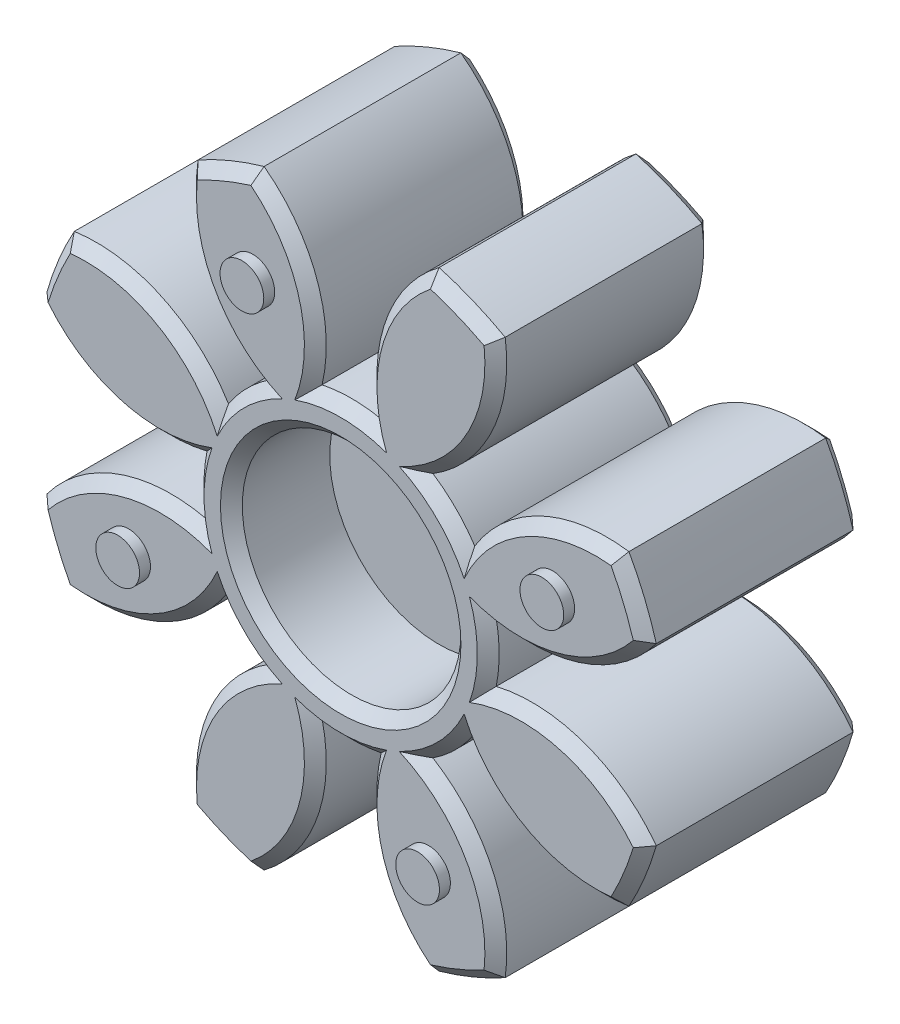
SolidWorks part; units mm, degrees
ref_plane "Front Plane" through (0, 0, 0) normal (0, 0, 1) x (1, 0, 0)
ref_plane "Top Plane" through (0, 0, 0) normal (0, 1, 0) x (1, 0, 0)
ref_plane "Right Plane" through (0, 0, 0) normal (1, 0, 0) x (0, 0, -1)
sketch "Sketch1" plane through (0, 0, 0) normal (0, 0, 1) x (1, 0, 0)
  circle A0 centre (0, 0) radius 7.25
  arc A1 (-5.4197, -6.3521) -> (-7.5645, -12.3704) centre (0, -11.675) ccw construction
  arc A2 (-3.3983, -14.0962) -> (-0.6593, -8.3239) centre (-8.2555, -8.2555) ccw construction
  arc A3 (-4.5836, -5.6172) -> (-7.4796, -13.0021) centre (0, -11.675) ccw
  arc A4 (-3.905, -14.4828) -> (-0.7309, -7.2131) centre (-8.2555, -8.2555) ccw
  arc A5 (-12.3704, -7.5645) -> (-6.3521, -5.4197) centre (-11.675, 0) ccw construction
  arc A6 (-8.3239, -0.6593) -> (-14.0962, -3.3983) centre (-8.2555, -8.2555) ccw construction
  arc A7 (-14.0962, 3.3983) -> (-8.3239, 0.6593) centre (-8.2555, 8.2555) ccw construction
  arc A8 (-6.3521, 5.4197) -> (-12.3704, 7.5645) centre (-11.675, 0) ccw construction
  arc A9 (-7.5645, 12.3704) -> (-5.4197, 6.3521) centre (0, 11.675) ccw construction
  arc A10 (-0.6593, 8.3239) -> (-3.3983, 14.0962) centre (-8.2555, 8.2555) ccw construction
  arc A11 (3.3983, 14.0962) -> (0.6593, 8.3239) centre (8.2555, 8.2555) ccw construction
  arc A12 (5.4197, 6.3521) -> (7.5645, 12.3704) centre (0, 11.675) ccw construction
  arc A13 (12.3704, 7.5645) -> (6.3521, 5.4197) centre (11.675, 0) ccw construction
  arc A14 (8.3239, 0.6593) -> (14.0962, 3.3983) centre (8.2555, 8.2555) ccw construction
  arc A15 (14.0962, -3.3983) -> (8.3239, -0.6593) centre (8.2555, -8.2555) ccw construction
  arc A16 (6.3521, -5.4197) -> (12.3704, -7.5645) centre (11.675, 0) ccw construction
  arc A17 (7.5645, -12.3704) -> (5.4197, -6.3521) centre (0, -11.675) ccw construction
  arc A18 (0.6593, -8.3239) -> (3.3983, -14.0962) centre (8.2555, -8.2555) ccw construction
  arc A19 (-13.0021, -7.4796) -> (-5.6172, -4.5836) centre (-11.675, 0) ccw
  arc A20 (-7.2131, -0.7309) -> (-14.4828, -3.905) centre (-8.2555, -8.2555) ccw
  arc A21 (-14.4828, 3.905) -> (-7.2131, 0.7309) centre (-8.2555, 8.2555) ccw
  arc A22 (-5.6172, 4.5836) -> (-13.0021, 7.4796) centre (-11.675, 0) ccw
  arc A23 (-7.4796, 13.0021) -> (-4.5836, 5.6172) centre (0, 11.675) ccw
  arc A24 (-0.7309, 7.2131) -> (-3.905, 14.4828) centre (-8.2555, 8.2555) ccw
  arc A25 (3.905, 14.4828) -> (0.7309, 7.2131) centre (8.2555, 8.2555) ccw
  arc A26 (4.5836, 5.6172) -> (7.4796, 13.0021) centre (0, 11.675) ccw
  arc A27 (13.0021, 7.4796) -> (5.6172, 4.5836) centre (11.675, 0) ccw
  arc A28 (7.2131, 0.7309) -> (14.4828, 3.905) centre (8.2555, 8.2555) ccw
  arc A29 (14.4828, -3.905) -> (7.2131, -0.7309) centre (8.2555, -8.2555) ccw
  arc A30 (5.6172, -4.5836) -> (13.0021, -7.4796) centre (11.675, 0) ccw
  arc A31 (7.4796, -13.0021) -> (4.5836, -5.6172) centre (0, -11.675) ccw
  arc A32 (0.7309, -7.2131) -> (3.905, -14.4828) centre (8.2555, -8.2555) ccw
  arc A33 (-13.0021, 7.4796) -> (-14.4828, 3.905) centre (0, 0) ccw
  arc A34 (-3.905, 14.4828) -> (-7.4796, 13.0021) centre (0, 0) ccw
  arc A35 (7.4796, 13.0021) -> (3.905, 14.4828) centre (0, 0) ccw
  arc A36 (14.4828, 3.905) -> (13.0021, 7.4796) centre (0, 0) ccw
  arc A37 (13.0021, -7.4796) -> (14.4828, -3.905) centre (0, 0) ccw
  arc A38 (3.905, -14.4828) -> (7.4796, -13.0021) centre (0, 0) ccw
  arc A39 (-7.4796, -13.0021) -> (-3.905, -14.4828) centre (0, 0) ccw
  arc A40 (-14.4828, -3.905) -> (-13.0021, -7.4796) centre (0, 0) ccw
  dimension "D1" = 14.5
  dimension "D2" = 30
extrude "Boss-Extrude1" add sketch "Sketch1" along normal blind 10 from offset 0.5 contours A30 A37 A29 A0 | A32 A38 A31 A0 | A3 A39 A4 A0 | A20 A40 A19 A0 | A22 A33 A21 A0 | A24 A34 A23 A0 | A26 A35 A25 A0 | A28 A36 A27 A0 | A0
sketch "Sketch2" plane through (0, 0, 10.5) normal (0, 0, 1) x (1, 0, 0)
  circle A0 centre (0, 0) radius 5
  dimension "D1" = 10
extrude "Cut-Extrude1" cut sketch "Sketch2" against normal blind 4.5
sketch "Sketch3" plane through (0, 0, 0.5) normal (0, 0, -1) x (-1, 0, 0)
  circle A0 centre (0, 0) radius 5
  dimension "D1" = 10
extrude "Cut-Extrude2" cut sketch "Sketch3" against normal blind 4.5
sketch "Sketch6" plane through (0, 0, 10.5) normal (0, 0, 1) x (1, 0, 0)
  arc A0 (5.6321, -3.7205) -> (12.6851, -7.0242) centre (11.675, 0) ccw
  arc A1 (12.6851, -7.0242) -> (13.9365, -4.0028) centre (0, 0) ccw
  arc A2 (13.9365, -4.0028) -> (6.6133, -1.3516) centre (8.2555, -8.2555) ccw
  arc A3 (6.6133, -1.3516) -> (6.6133, 1.3516) centre (0, 0) ccw
  arc A4 (6.6133, 1.3516) -> (13.9365, 4.0028) centre (8.2555, 8.2555) ccw
  arc A5 (13.9365, 4.0028) -> (12.6851, 7.0242) centre (0, 0) ccw
  arc A6 (12.6851, 7.0242) -> (5.6321, 3.7205) centre (11.675, 0) ccw
  arc A7 (5.6321, 3.7205) -> (3.7205, 5.6321) centre (0, 0) ccw
  arc A8 (3.7205, 5.6321) -> (7.0242, 12.6851) centre (0, 11.675) ccw
  arc A9 (7.0242, 12.6851) -> (4.0028, 13.9365) centre (0, 0) ccw
  arc A10 (4.0028, 13.9365) -> (1.3516, 6.6133) centre (8.2555, 8.2555) ccw
  arc A11 (1.3516, 6.6133) -> (-1.3516, 6.6133) centre (0, 0) ccw
  arc A12 (-1.3516, 6.6133) -> (-4.0028, 13.9365) centre (-8.2555, 8.2555) ccw
  arc A13 (-4.0028, 13.9365) -> (-7.0242, 12.6851) centre (0, 0) ccw
  arc A14 (-7.0242, 12.6851) -> (-3.7205, 5.6321) centre (0, 11.675) ccw
  arc A15 (-3.7205, 5.6321) -> (-5.6321, 3.7205) centre (0, 0) ccw
  arc A16 (-5.6321, 3.7205) -> (-12.6851, 7.0242) centre (-11.675, 0) ccw
  arc A17 (-12.6851, 7.0242) -> (-13.9365, 4.0028) centre (0, 0) ccw
  arc A18 (-13.9365, 4.0028) -> (-6.6133, 1.3516) centre (-8.2555, 8.2555) ccw
  arc A19 (-6.6133, 1.3516) -> (-6.6133, -1.3516) centre (0, 0) ccw
  arc A20 (-6.6133, -1.3516) -> (-13.9365, -4.0028) centre (-8.2555, -8.2555) ccw
  arc A21 (-13.9365, -4.0028) -> (-12.6851, -7.0242) centre (0, 0) ccw
  arc A22 (-12.6851, -7.0242) -> (-5.6321, -3.7205) centre (-11.675, 0) ccw
  arc A23 (-5.6321, -3.7205) -> (-3.7205, -5.6321) centre (0, 0) ccw
  arc A24 (-3.7205, -5.6321) -> (-7.0242, -12.6851) centre (0, -11.675) ccw
  arc A25 (-7.0242, -12.6851) -> (-4.0028, -13.9365) centre (0, 0) ccw
  arc A26 (-4.0028, -13.9365) -> (-1.3516, -6.6133) centre (-8.2555, -8.2555) ccw
  arc A27 (-1.3516, -6.6133) -> (1.3516, -6.6133) centre (0, 0) ccw
  arc A28 (1.3516, -6.6133) -> (4.0028, -13.9365) centre (8.2555, -8.2555) ccw
  arc A29 (4.0028, -13.9365) -> (7.0242, -12.6851) centre (0, 0) ccw
  arc A30 (7.0242, -12.6851) -> (3.7205, -5.6321) centre (0, -11.675) ccw
  arc A31 (3.7205, -5.6321) -> (5.6321, -3.7205) centre (0, 0) ccw
  arc A32 (5.6172, -4.5836) -> (13.0021, -7.4796) centre (11.675, 0) ccw
  arc A33 (13.0021, -7.4796) -> (14.4828, -3.905) centre (0, 0) ccw
  arc A34 (14.4828, -3.905) -> (7.2131, -0.7309) centre (8.2555, -8.2555) ccw
  arc A35 (7.2131, -0.7309) -> (7.2131, 0.7309) centre (0, 0) ccw
  arc A36 (7.2131, 0.7309) -> (14.4828, 3.905) centre (8.2555, 8.2555) ccw
  arc A37 (14.4828, 3.905) -> (13.0021, 7.4796) centre (0, 0) ccw
  arc A38 (13.0021, 7.4796) -> (5.6172, 4.5836) centre (11.675, 0) ccw
  arc A39 (5.6172, 4.5836) -> (4.5836, 5.6172) centre (0, 0) ccw
  arc A40 (4.5836, 5.6172) -> (7.4796, 13.0021) centre (0, 11.675) ccw
  arc A41 (7.4796, 13.0021) -> (3.905, 14.4828) centre (0, 0) ccw
  arc A42 (3.905, 14.4828) -> (0.7309, 7.2131) centre (8.2555, 8.2555) ccw
  arc A43 (0.7309, 7.2131) -> (-0.7309, 7.2131) centre (0, 0) ccw
  arc A44 (-0.7309, 7.2131) -> (-3.905, 14.4828) centre (-8.2555, 8.2555) ccw
  arc A45 (-3.905, 14.4828) -> (-7.4796, 13.0021) centre (0, 0) ccw
  arc A46 (-7.4796, 13.0021) -> (-4.5836, 5.6172) centre (0, 11.675) ccw
  arc A47 (-4.5836, 5.6172) -> (-5.6172, 4.5836) centre (0, 0) ccw
  arc A48 (-5.6172, 4.5836) -> (-13.0021, 7.4796) centre (-11.675, 0) ccw
  arc A49 (-13.0021, 7.4796) -> (-14.4828, 3.905) centre (0, 0) ccw
  arc A50 (-14.4828, 3.905) -> (-7.2131, 0.7309) centre (-8.2555, 8.2555) ccw
  arc A51 (-7.2131, 0.7309) -> (-7.2131, -0.7309) centre (0, 0) ccw
  arc A52 (-7.2131, -0.7309) -> (-14.4828, -3.905) centre (-8.2555, -8.2555) ccw
  arc A53 (-14.4828, -3.905) -> (-13.0021, -7.4796) centre (0, 0) ccw
  arc A54 (-13.0021, -7.4796) -> (-5.6172, -4.5836) centre (-11.675, 0) ccw
  arc A55 (-5.6172, -4.5836) -> (-4.5836, -5.6172) centre (0, 0) ccw
  arc A56 (-4.5836, -5.6172) -> (-7.4796, -13.0021) centre (0, -11.675) ccw
  arc A57 (-7.4796, -13.0021) -> (-3.905, -14.4828) centre (0, 0) ccw
  arc A58 (-3.905, -14.4828) -> (-0.7309, -7.2131) centre (-8.2555, -8.2555) ccw
  arc A59 (-0.7309, -7.2131) -> (0.7309, -7.2131) centre (0, 0) ccw
  arc A60 (0.7309, -7.2131) -> (3.905, -14.4828) centre (8.2555, -8.2555) ccw
  arc A61 (3.905, -14.4828) -> (7.4796, -13.0021) centre (0, 0) ccw
  arc A62 (7.4796, -13.0021) -> (4.5836, -5.6172) centre (0, -11.675) ccw
  arc A63 (4.5836, -5.6172) -> (5.6172, -4.5836) centre (0, 0) ccw
  arc A64 (5.6172, -4.5836) -> (13.0021, -7.4796) centre (11.675, 0) ccw
  arc A65 (13.0021, -7.4796) -> (14.4828, -3.905) centre (0, 0) ccw
  arc A66 (14.4828, -3.905) -> (7.2131, -0.7309) centre (8.2555, -8.2555) ccw
  arc A67 (7.2131, -0.7309) -> (7.2131, 0.7309) centre (0, 0) ccw
  arc A68 (7.2131, 0.7309) -> (14.4828, 3.905) centre (8.2555, 8.2555) ccw
  arc A69 (14.4828, 3.905) -> (13.0021, 7.4796) centre (0, 0) ccw
  arc A70 (13.0021, 7.4796) -> (5.6172, 4.5836) centre (11.675, 0) ccw
  arc A71 (5.6172, 4.5836) -> (4.5836, 5.6172) centre (0, 0) ccw
  arc A72 (4.5836, 5.6172) -> (7.4796, 13.0021) centre (0, 11.675) ccw
  arc A73 (7.4796, 13.0021) -> (3.905, 14.4828) centre (0, 0) ccw
  arc A74 (3.905, 14.4828) -> (0.7309, 7.2131) centre (8.2555, 8.2555) ccw
  arc A75 (0.7309, 7.2131) -> (-0.7309, 7.2131) centre (0, 0) ccw
  arc A76 (-0.7309, 7.2131) -> (-3.905, 14.4828) centre (-8.2555, 8.2555) ccw
  arc A77 (-3.905, 14.4828) -> (-7.4796, 13.0021) centre (0, 0) ccw
  arc A78 (-7.4796, 13.0021) -> (-4.5836, 5.6172) centre (0, 11.675) ccw
  arc A79 (-4.5836, 5.6172) -> (-5.6172, 4.5836) centre (0, 0) ccw
  arc A80 (-5.6172, 4.5836) -> (-13.0021, 7.4796) centre (-11.675, 0) ccw
  arc A81 (-13.0021, 7.4796) -> (-14.4828, 3.905) centre (0, 0) ccw
  arc A82 (-14.4828, 3.905) -> (-7.2131, 0.7309) centre (-8.2555, 8.2555) ccw
  arc A83 (-7.2131, 0.7309) -> (-7.2131, -0.7309) centre (0, 0) ccw
  arc A84 (-7.2131, -0.7309) -> (-14.4828, -3.905) centre (-8.2555, -8.2555) ccw
  arc A85 (-14.4828, -3.905) -> (-13.0021, -7.4796) centre (0, 0) ccw
  arc A86 (-13.0021, -7.4796) -> (-5.6172, -4.5836) centre (-11.675, 0) ccw
  arc A87 (-5.6172, -4.5836) -> (-4.5836, -5.6172) centre (0, 0) ccw
  arc A88 (-4.5836, -5.6172) -> (-7.4796, -13.0021) centre (0, -11.675) ccw
  arc A89 (-7.4796, -13.0021) -> (-3.905, -14.4828) centre (0, 0) ccw
  arc A90 (-3.905, -14.4828) -> (-0.7309, -7.2131) centre (-8.2555, -8.2555) ccw
  arc A91 (-0.7309, -7.2131) -> (0.7309, -7.2131) centre (0, 0) ccw
  arc A92 (0.7309, -7.2131) -> (3.905, -14.4828) centre (8.2555, -8.2555) ccw
  arc A93 (3.905, -14.4828) -> (7.4796, -13.0021) centre (0, 0) ccw
  arc A94 (7.4796, -13.0021) -> (4.5836, -5.6172) centre (0, -11.675) ccw
  arc A95 (4.5836, -5.6172) -> (5.6172, -4.5836) centre (0, 0) ccw
  dimension "D1" = 0
  dimension "D2" = 0.5
extrude "Cut-Extrude3" cut sketch "Sketch6" against normal through all
chamfer "Chamfer2" distance 0.5 angle 45 66 edges at (5.5489, -13.3963, 10.5) (1.5828, -10.6711, 10.5) (0, -6.75, 10.5) (-1.5828, -10.6711, 10.5) (-5.5489, -13.3963, 10.5) (-6.4264, -8.6648, 10.5) (-4.773, -4.773, 10.5) (-8.6648, -6.4264, 10.5) (-13.3963, -5.5489, 10.5) (-10.6711, -1.5828, 10.5) (-6.75, 0, 10.5) (-10.6711, 1.5828, 10.5) (-13.3963, 5.5489, 10.5) (-8.6648, 6.4264, 10.5) (-4.773, 4.773, 10.5) (-6.4264, 8.6648, 10.5) (-5.5489, 13.3963, 10.5) (-1.5828, 10.6711, 10.5) (0, 6.75, 10.5) (1.5828, 10.6711, 10.5) (5.5489, 13.3963, 10.5) (6.4264, 8.6648, 10.5) (4.773, 4.773, 10.5) (8.6648, 6.4264, 10.5) (13.3963, 5.5489, 10.5) (10.6711, 1.5828, 10.5) (6.75, 0, 10.5) (10.6711, -1.5828, 10.5) (13.3963, -5.5489, 10.5) (8.6648, -6.4264, 10.5) (4.773, -4.773, 10.5) (6.4264, -8.6648, 10.5) (5, 0, 10.5) (8.6648, -6.4264, 0.5) (13.3963, -5.5489, 0.5) (10.6711, -1.5828, 0.5) (6.75, 0, 0.5) (10.6711, 1.5828, 0.5) (13.3963, 5.5489, 0.5) (8.6648, 6.4264, 0.5) (4.773, 4.773, 0.5) (6.4264, 8.6648, 0.5) (5.5489, 13.3963, 0.5) (1.5828, 10.6711, 0.5) (0, 6.75, 0.5) (-1.5828, 10.6711, 0.5) (-5.5489, 13.3963, 0.5) (-6.4264, 8.6648, 0.5) (-4.773, 4.773, 0.5) (-8.6648, 6.4264, 0.5) (-13.3963, 5.5489, 0.5) (-10.6711, 1.5828, 0.5) (-6.75, 0, 0.5) (-10.6711, -1.5828, 0.5) (-13.3963, -5.5489, 0.5) (-8.6648, -6.4264, 0.5) (-4.773, -4.773, 0.5) (-6.4264, -8.6648, 0.5) (-5.5489, -13.3963, 0.5) (-1.5828, -10.6711, 0.5) (0, -6.75, 0.5) (1.5828, -10.6711, 0.5) (5.5489, -13.3963, 0.5) (6.4264, -8.6648, 0.5) (4.773, -4.773, 0.5) (-5, 0, 0.5)
sketch "Sketch4" plane through (0, 0, 0.5) normal (0, 0, -1) x (-1, 0, 0)
  line L0 (0, 0) -> (13.3963, 5.5489) construction
  circle A1 centre (9.7007, 4.0182) radius 1
  arc A3 (13.9365, 4.0028) -> (12.6851, 7.0242) centre (0, 0) ccw construction
  dimension "D1" = 2
  dimension "D2" = 4
extrude "Boss-Extrude2" add sketch "Sketch4" along normal blind 0.5
sketch "Sketch5" plane through (0, 0, 10.5) normal (0, 0, 1) x (1, 0, 0)
  line L0 (0, 0) -> (-13.3963, -5.5489) construction
  circle A1 centre (-9.7007, -4.0182) radius 1
  arc A3 (-13.9365, -4.0028) -> (-12.6851, -7.0242) centre (0, 0) ccw construction
  dimension "D2" = 2
  dimension "D1" = 4
extrude "Boss-Extrude3" add sketch "Sketch5" along normal blind 0.5
pattern_circular "CirPattern1" count 4 over 360 about axis through (0, 0, 0) along (0, 0, 1) of "Boss-Extrude3", "Boss-Extrude2"
